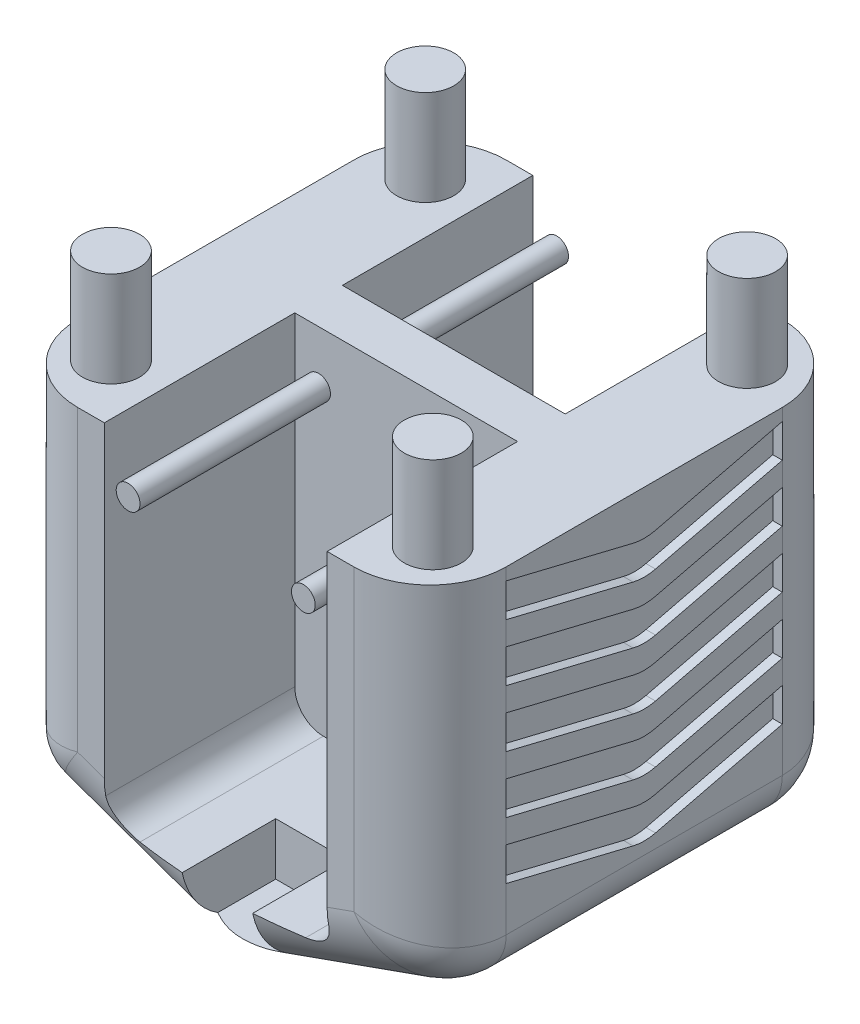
SolidWorks part; units mm, degrees
ref_plane "Plan de face" through (0, 0, 0) normal (0, 0, 1) x (1, 0, 0)
ref_plane "Plan de dessus" through (0, 0, 0) normal (0, 1, 0) x (1, 0, 0)
ref_plane "Plan de droite" through (0, 0, 0) normal (1, 0, 0) x (0, 0, -1)
sketch "Esquisse1" plane through (0, 0, 0) normal (0, 0, 1) x (1, 0, 0)
  line L0 (-19.939, 17.6524) -> (25.061, 17.6524)
  line L1 (25.061, 17.6524) -> (25.061, -15.8187)
  line L2 (21.736, -20.5298) -> (5.9111, -26.1564)
  line L3 (-0.7891, -26.1564) -> (-16.6141, -20.5298)
  line L4 (-19.939, -15.8187) -> (-19.939, 17.6524)
  arc A0 (5.9111, -26.1564) -> (-0.7891, -26.1564) centre (2.561, -16.7343) cw
  arc A1 (21.736, -20.5298) -> (25.061, -15.8187) centre (20.061, -15.8187) ccw
  arc A2 (-16.6141, -20.5298) -> (-19.939, -15.8187) centre (-14.939, -15.8187) cw
  point P7 (2.561, -27.3476)
  point P12 (-19.939, -19.3476)
  dimension "D4" = 10
  dimension "D5" = 5
  dimension "D1" = 45
  dimension "D2" = 45
  dimension "D3" = 37
extrude "Boss.-Extru.1" add sketch "Esquisse1" along normal blind 22.5
sketch "Esquisse3" plane through (0, 0, 22.5) normal (0, 0, 1) x (1, 0, 0)
  line L1 (25.061, 17.6524) -> (-19.939, 17.6524) construction
  line L2 (14.261, 17.6524) -> (-9.139, 17.6524)
  line L3 (14.261, 17.6524) -> (14.261, -16.3476)
  line L4 (11.261, -19.3476) -> (-6.139, -19.3476)
  line L5 (-9.139, 17.6524) -> (-9.139, -16.3476)
  line L6 (25.061, -15.8187) -> (25.061, 17.6524) construction
  line L7 (-19.939, 17.6524) -> (-19.939, -15.8187) construction
  arc A0 (11.261, -19.3476) -> (14.261, -16.3476) centre (11.261, -16.3476) ccw
  arc A1 (-6.139, -19.3476) -> (-9.139, -16.3476) centre (-6.139, -16.3476) cw
  circle A2 centre (-6.639, 12.1524) radius 1.25
  circle A3 centre (11.761, 12.1524) radius 1.25
  dimension "D4" = 3
  dimension "D7" = 5.5
  dimension "D9" = 2.5
  dimension "D10" = 2.5
  dimension "D1" = 10.8
  dimension "D2" = 10.8
  dimension "D3" = 37
  dimension "D5" = 5.5
  dimension "D6" = 2.5
  dimension "D8" = 2.5
extrude "Enlèv. mat.-Extru.1" cut sketch "Esquisse3" against normal blind 20
sketch "Esquisse7" plane through (0, 0, 22.5) normal (0, 0, 1) x (1, 0, 0)
  line L0 (-6.139, -19.3476) -> (11.261, -19.3476) construction
  line L1 (-1.139, -19.3476) -> (6.261, -19.3476)
  line L2 (-1.139, -19.3476) -> (-1.139, -24.8476)
  line L3 (-1.139, -24.8476) -> (6.261, -24.8476)
  line L4 (6.261, -19.3476) -> (6.261, -24.8476)
  line L5 (-9.139, 17.6524) -> (-9.139, -16.3476) construction
  line L9 (14.261, -16.3476) -> (14.261, 17.6524) construction
  dimension "D1" = 0
  dimension "D2" = 8
  dimension "D3" = 5.5
  dimension "D4" = 8
extrude "Enlèv. mat.-Extru.2" cut sketch "Esquisse7" against normal blind 10
mirror "Symétrie1" about plane through (20.061, -15.8187, 0) normal (0, 0, 1) of "Enlèv. mat.-Extru.1", "Boss.-Extru.1", "Enlèv. mat.-Extru.2"
sketch "Esquisse8" plane through (0, 17.6524, 0) normal (0, 1, 0) x (1, 0, 0)
  line L0 (-9.139, 22.5) -> (-19.939, 22.5) construction
  line L1 (-19.939, -22.5) -> (-19.939, 22.5) construction
  circle A0 centre (-14.439, 16.5) radius 3
  circle A1 centre (19.361, 16.5) radius 3
  circle A2 centre (19.361, -16.5) radius 3
  circle A3 centre (-14.439, -16.5) radius 3
  dimension "D5" = 6
  dimension "D1" = 6
  dimension "D2" = 5.5
  dimension "D3" = 2
  dimension "D4" = 2
extrude "Boss.-Extru.2" add sketch "Esquisse8" along normal blind 10
fillet "Congé1" radius 8 14 edges at (-19.0241, -18.7018, -22.5) (-8.7016, -23.3431, -22.5) (2.561, -26.7343, -22.5) (13.8235, -23.3431, -22.5) (24.146, -18.7018, -22.5) (-19.0241, -18.7018, 22.5) (-8.7016, -23.3431, 22.5) (2.561, -26.7343, 22.5) (13.8235, -23.3431, 22.5) (24.146, -18.7018, 22.5) (-19.939, 0.9169, -22.5) (25.061, 0.9169, -22.5) (-19.939, 0.9169, 22.5) (25.061, 0.9169, 22.5)
sketch "Esquisse10" plane through (25.061, 0, 0) normal (1, 0, 0) x (0, 0, -1)
  line L0 (-14.5, 16.3751) -> (-1.1811, 13.1372)
  line L1 (-14.5, 17.6524) -> (-14.5, -15.8187) construction
  line L2 (1.1811, 13.1372) -> (14.5, 16.3751)
  line L3 (14.5, -15.8187) -> (14.5, 17.6524) construction
  line L4 (14.5, 16.3751) -> (14.5, 12.8501)
  line L5 (14.5, 12.8501) -> (1.1811, 9.6123)
  line L6 (-1.1811, 9.6123) -> (-14.5, 12.8501)
  line L7 (-14.5, 12.8501) -> (-14.5, 16.3751)
  line L8 (-14.5, 10.3751) -> (-1.1811, 7.1372)
  line L9 (-1.1811, 3.6123) -> (-14.5, 6.8501)
  line L10 (-14.5, 6.8501) -> (-14.5, 10.3751)
  line L11 (1.1811, 7.1372) -> (14.5, 10.3751)
  line L12 (14.5, 6.8501) -> (1.1811, 3.6123)
  line L13 (14.5, 10.3751) -> (14.5, 6.8501)
  line L14 (-14.5, 4.3751) -> (-1.1811, 1.1372)
  line L15 (-1.1811, -2.3877) -> (-14.5, 0.8501)
  line L16 (-14.5, 0.8501) -> (-14.5, 4.3751)
  line L17 (1.1811, 1.1372) -> (14.5, 4.3751)
  line L18 (14.5, 0.8501) -> (1.1811, -2.3877)
  line L19 (14.5, 4.3751) -> (14.5, 0.8501)
  line L20 (-14.5, -1.6249) -> (-1.1811, -4.8628)
  line L21 (-1.1811, -8.3877) -> (-14.5, -5.1499)
  line L22 (-14.5, -5.1499) -> (-14.5, -1.6249)
  line L23 (1.1811, -4.8628) -> (14.5, -1.6249)
  line L24 (14.5, -5.1499) -> (1.1811, -8.3877)
  line L25 (14.5, -1.6249) -> (14.5, -5.1499)
  line L26 (-14.5, -7.6249) -> (-1.1811, -10.8628)
  line L27 (-1.1811, -14.3877) -> (-14.5, -11.1499)
  line L28 (-14.5, -11.1499) -> (-14.5, -7.6249)
  line L29 (1.1811, -10.8628) -> (14.5, -7.6249)
  line L30 (14.5, -11.1499) -> (1.1811, -14.3877)
  line L31 (14.5, -7.6249) -> (14.5, -11.1499)
  arc A0 (-1.1811, 9.6123) -> (1.1811, 9.6123) centre (0, 14.4708) ccw
  arc A1 (1.1811, 13.1372) -> (-1.1811, 13.1372) centre (0, 17.9957) cw
  arc A2 (1.1811, 7.1372) -> (-1.1811, 7.1372) centre (0, 11.9957) cw
  arc A3 (-1.1811, 3.6123) -> (1.1811, 3.6123) centre (0, 8.4708) ccw
  arc A4 (1.1811, 1.1372) -> (-1.1811, 1.1372) centre (0, 5.9957) cw
  arc A5 (-1.1811, -2.3877) -> (1.1811, -2.3877) centre (0, 2.4708) ccw
  arc A6 (1.1811, -4.8628) -> (-1.1811, -4.8628) centre (0, -0.0043) cw
  arc A7 (-1.1811, -8.3877) -> (1.1811, -8.3877) centre (0, -3.5292) ccw
  arc A8 (1.1811, -10.8628) -> (-1.1811, -10.8628) centre (0, -6.0043) cw
  arc A9 (-1.1811, -14.3877) -> (1.1811, -14.3877) centre (0, -9.5292) ccw
  dimension "D1" = 5
  dimension "D2" = 5
extrude "Enlèv. mat.-Extru.11" cut sketch "Esquisse10" against normal blind 1
pattern_linear "Répétition linéaire1" count 2 spacing 44 along (-1, 0, 0) of "Enlèv. mat.-Extru.11"
